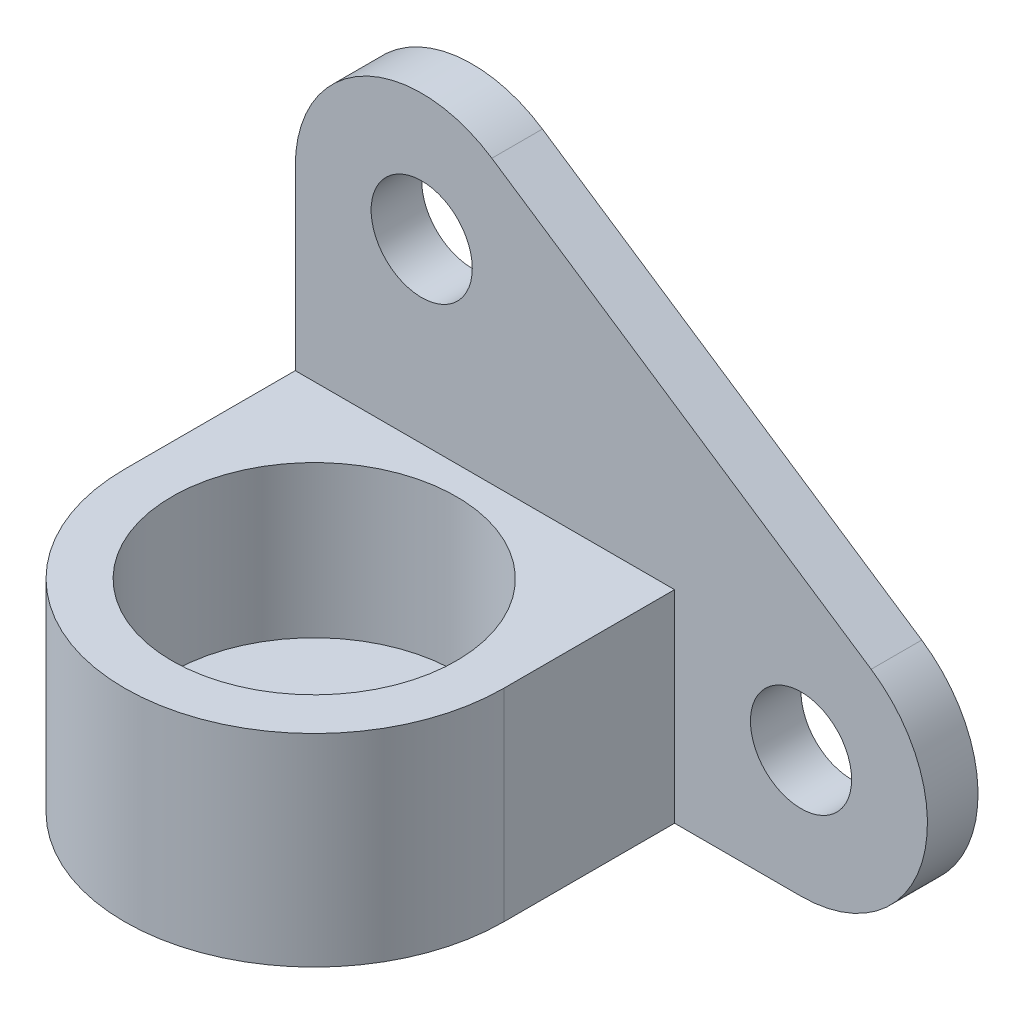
SolidWorks part; units mm, degrees
ref_plane "face" through (0, 0, 0) normal (0, 0, 1) x (1, 0, 0)
ref_plane "dessus" through (0, 0, 0) normal (0, 1, 0) x (1, 0, 0)
ref_plane "profil" through (0, 0, 0) normal (1, 0, 0) x (0, 0, -1)
sketch "Esquisse1" plane through (0, 0, 0) normal (0, 0, 1) x (1, 0, 0)
  line L0 (0, 0) -> (80, 0)
  line L1 (0, 0) -> (0, 60)
  line L2 (31.094, 76.641) -> (91.094, 36.641)
  arc A0 (31.094, 76.641) -> (0, 60) centre (20, 60) ccw
  arc A1 (80, 0) -> (91.094, 36.641) centre (80, 20) ccw
  dimension "D5" = 20
  dimension "D1" = 80
  dimension "D2" = 60
  dimension "D3" = 60
  dimension "D4" = 20
  dimension "D6" = 80
extrude "Base-Extrusion" add sketch "Esquisse1" along normal blind 8
sketch "Esquisse3" plane through (0, 0, 0) normal (0, -1, 0) x (1, 0, 0)
  line L1 (0, 8) -> (60, 8)
  line L2 (0, 8) -> (0, 35)
  line L4 (60, 8) -> (60, 35)
  arc A0 (60, 35) -> (0, 35) centre (30, 35) ccw
  dimension "D3" = 30
  dimension "D5" = 60
  dimension "D1" = 60
  dimension "D4" = 27
extrude "Boss.-Extru.1" add sketch "Esquisse3" against normal blind 32
sketch "Esquisse4" plane through (0, 32, 0) normal (0, 1, 0) x (-1, 0, 0)
  circle A0 centre (-30, 35) radius 22.5
  dimension "D1" = 45
extrude "Enlèv. mat.-Extru.1" cut sketch "Esquisse4" against normal blind 24
sketch "Esquisse5" plane through (0, 8, 0) normal (0, 1, 0) x (-1, 0, 0)
  circle A0 centre (-30, 35) radius 9
  dimension "D1" = 18
extrude "Enlèv. mat.-Extru.2" cut sketch "Esquisse5" against normal through all
sketch "Esquisse6" plane through (0, 0, 8) normal (0, 0, 1) x (1, 0, 0)
  circle A0 centre (20, 60) radius 8
  circle A1 centre (80, 20) radius 8
  dimension "D1" = 16
  dimension "D2" = 16
extrude "Enlèv. mat.-Extru.3" cut sketch "Esquisse6" against normal through all
sketch "Esquisse7" plane through (0, 32, 0) normal (0, 1, 0) x (-1, 0, 0)
  line L1 (-30, 35) -> (-74.1001, 35)
  line L2 (-30, 35) -> (-30, 77.2575)
  line L3 (-30, 77.2575) -> (-74.1001, 77.2575)
  line L4 (-74.1001, 35) -> (-74.1001, 77.2575)
extrude "Enlèv. mat.-Extru.4" cut sketch "Esquisse7" against normal through all
